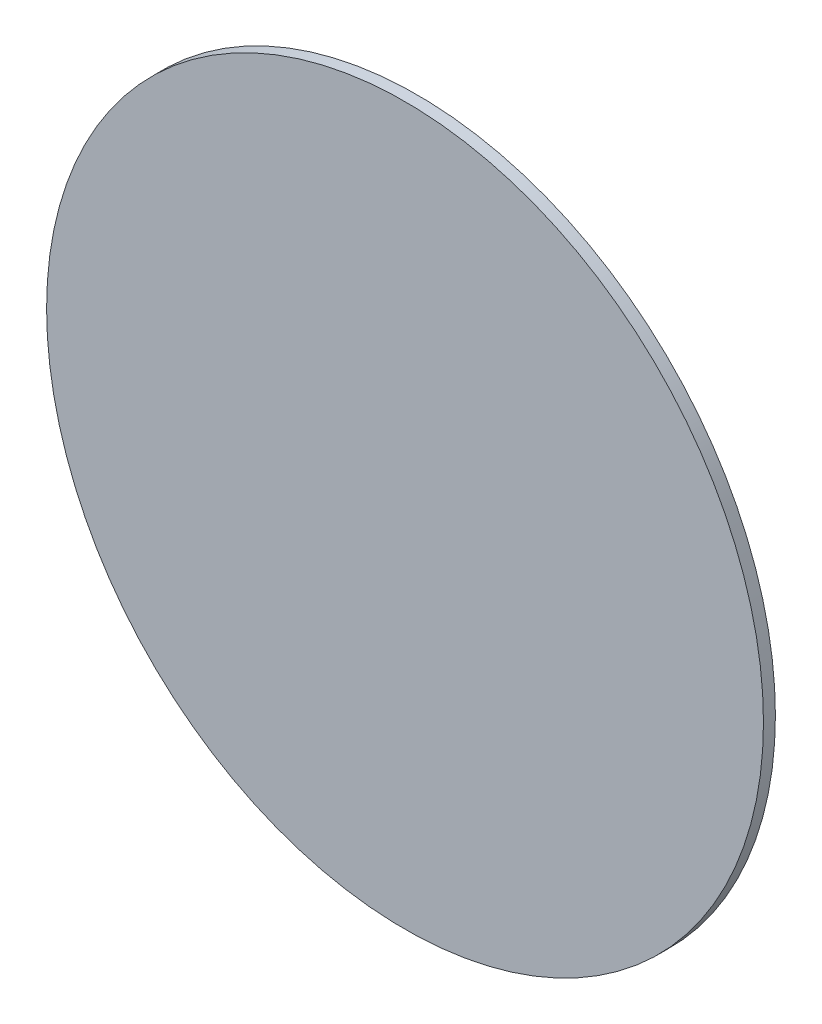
SolidWorks part; units mm, degrees
ref_plane "Front Plane" through (0, 0, 0) normal (0, 0, 1) x (1, 0, 0)
ref_plane "Top Plane" through (0, 0, 0) normal (0, 1, 0) x (1, 0, 0)
ref_plane "Right Plane" through (0, 0, 0) normal (1, 0, 0) x (0, 0, -1)
sketch "Sketch1" plane through (0, 0, 0) normal (0, 0, 1) x (1, 0, 0)
  circle A0 centre (0, 0) radius 381
  dimension "D1" = 762
extrude "Boss-Extrude1" add sketch "Sketch1" along normal blind 12.7
